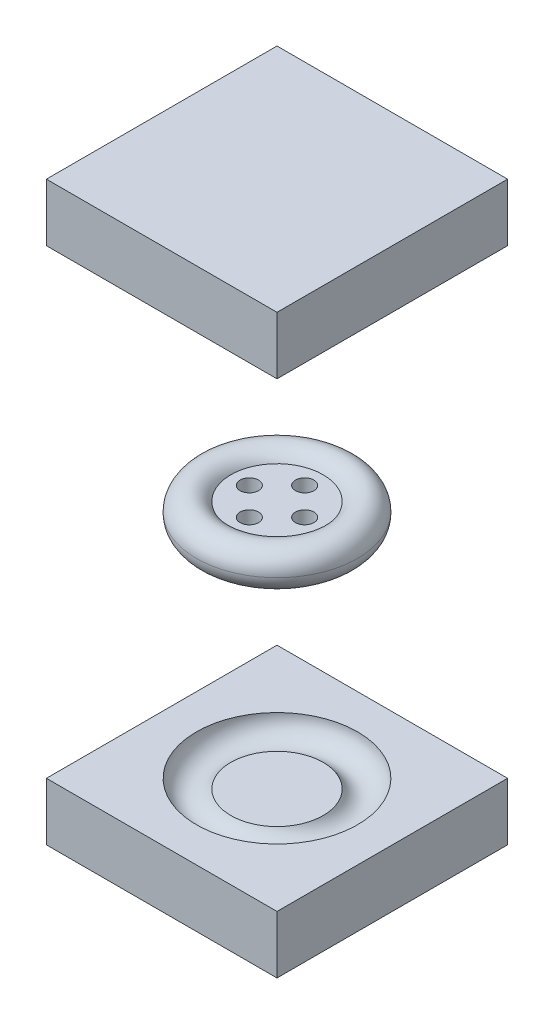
SolidWorks part; units mm, degrees
ref_plane "Front Plane" through (0, 0, 0) normal (0, 0, 1) x (1, 0, 0)
ref_plane "Top Plane" through (0, 0, 0) normal (0, 1, 0) x (1, 0, 0)
ref_plane "Right Plane" through (0, 0, 0) normal (1, 0, 0) x (0, 0, -1)
sketch "Sketch1" plane through (0, 0, 0) normal (0, 0, 1) x (1, 0, 0)
  line L0 (0, -4) -> (0, 4)
  line L1 (0, 4) -> (20, 4)
  line L2 (0, 0) -> (26.9282, 0) construction
  line L3 (0, -4) -> (20, -4)
  arc A0 (20, -4) -> (20, 4) centre (26.9282, 0) ccw
  dimension "D3" = 8
  dimension "D1" = 8
  dimension "D2" = 20
revolve "Revolve1" add sketch "Sketch1" angle 360 about L0
sketch "Sketch2" plane through (0, 4, 0) normal (0, 1, 0) x (1, 0, 0)
  circle A0 centre (12, 0) radius 4
  circle A1 centre (0, -12) radius 4
  circle A2 centre (-12, 0) radius 4
  circle A3 centre (0, 12) radius 4
  point P12 (0, 0)
  dimension "D1" = 8
  dimension "D2" = 12
  dimension "D3" = 4
extrude "Cut-Extrude1" cut sketch "Sketch2" against normal blind 10 draft 2
other "Parting Line2"
other "Parting Surface1" parameters "D1"=50
other "Shut-Off Surface1"
sketch "Sketch3" plane through (0, 0, 0) normal (0, -1, 0) x (1, 0, 0)
  line L1 (-50, -50) -> (50, -50)
  line L2 (-50, -50) -> (-50, 50)
  line L3 (-50, 50) -> (50, 50)
  line L4 (50, -50) -> (50, 50)
  line L5 (-50, -50) -> (50, 50) construction
  line L6 (-50, 50) -> (50, -50) construction
  point P0 (0, 0)
  dimension "D1" = 100
  dimension "D2" = 100
other "Tooling Split1" parameters "D1"=25, "D2"=25, "D3"=3
move or copy body "Body-Move/Copy1" bodies to move or copy 108 copy no translate (0, 100, 0) parameters "D1"=0, "D2"=100, "D3"=0
move or copy body "Body-Move/Copy2" bodies to move or copy 107 copy no translate (0, -100, 0) parameters "D1"=0, "D2"=100, "D3"=0
other "Save Bodies1"
